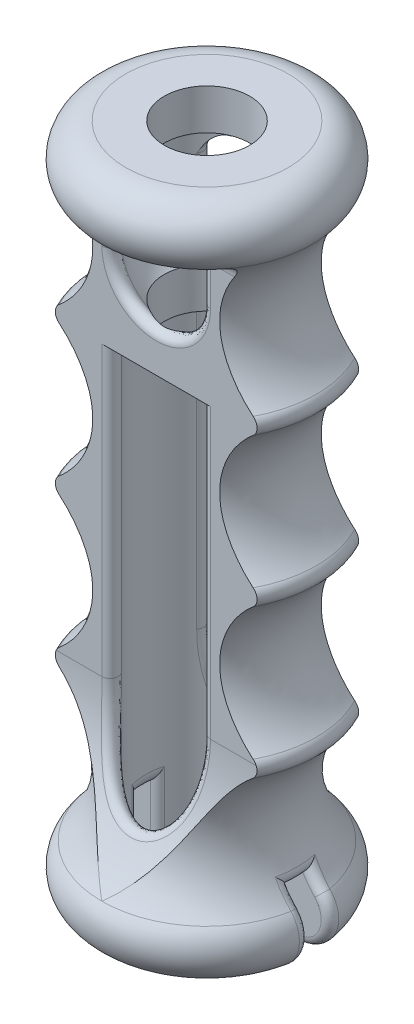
SolidWorks part; units mm, degrees
ref_plane "Front Plane" through (0, 0, 0) normal (0, 0, 1) x (1, 0, 0)
ref_plane "Top Plane" through (0, 0, 0) normal (0, 1, 0) x (1, 0, 0)
ref_plane "Right Plane" through (0, 0, 0) normal (1, 0, 0) x (0, 0, -1)
sketch "Sketch1" plane through (0, 0, 0) normal (0, 0, 1) x (1, 0, 0)
  line L0 (0, 0) -> (0, -84.6703) construction
  line L1 (-6.6675, 0) -> (-6.6675, -6.35)
  line L2 (-6.6675, -6.35) -> (-9.525, -6.35)
  line L3 (-9.525, -6.35) -> (-9.525, -17.2314)
  line L4 (-6.6675, -24.13) -> (-4.2872, -26.5103) construction
  line L5 (-6.6675, -24.13) -> (-6.6675, -30.48)
  line L6 (-6.6675, -30.48) -> (-9.525, -30.48)
  line L7 (-9.525, -30.48) -> (-9.525, -100.8395)
  line L8 (-9.525, -100.8395) -> (0, -100.8395)
  line L9 (0, -100.8395) -> (0, -105.9195)
  line L10 (0, -105.9195) -> (-12.7, -105.9195)
  line L11 (-12.7, 0) -> (-6.6675, 0)
  arc A0 (-12.7, -105.9195) -> (-16.4474, -97.4097) centre (-12.7, -100.8395) cw
  arc A1 (-16.4474, -8.5097) -> (-17.1048, -28.4724) centre (-26.986, -18.1549) cw
  arc A2 (-17.1048, -77.4471) -> (-17.1048, -74.8789) centre (-15.875, -76.163) cw
  arc A3 (-17.1048, -31.0406) -> (-17.1048, -51.6756) centre (-26.986, -41.3581) cw
  arc A4 (-17.1048, -54.2438) -> (-17.1048, -51.6756) centre (-15.875, -52.9597) cw
  arc A5 (-17.1048, -54.2438) -> (-17.1048, -74.8789) centre (-26.986, -64.5614) cw
  arc A6 (-17.1048, -31.0406) -> (-17.1048, -28.4724) centre (-15.875, -29.7565) cw
  arc A7 (-17.1048, -77.4471) -> (-16.4474, -97.4097) centre (-26.986, -87.7646) cw
  arc A8 (-16.4474, -8.5097) -> (-12.7, 0) centre (-12.7, -5.08) cw
  arc A9 (-6.6675, -24.13) -> (-9.525, -17.2314) centre (0.2311, -17.2314) cw
  dimension "D2" = 1.778
  dimension "D3" = 5.08
  dimension "D4" = 6.35
  dimension "D11" = 3.175
  dimension "D1" = 88.9
  dimension "D5" = 6.35
  dimension "D6" = 17.78
  dimension "D7" = 5.08
  dimension "D8" = 19.05
  dimension "D9" = 13.335
  dimension "D10" = 13.335
  dimension "D12" = 6.35
  dimension "D13" = 12.7
  dimension "D14" = 45
revolve "Revolve1" add sketch "Sketch1" angle 360 about L0
sketch "Sketch2" plane through (0, 0, 0) normal (1, 0, 0) x (0, 0, -1)
  line L0 (-16.4474, -8.5097) -> (-7.9375, -8.5097)
  line L1 (-16.4474, -8.5097) -> (16.4474, -8.5097) construction
  line L2 (-7.9375, -8.5097) -> (-7.9375, -75.5069)
  line L3 (0, 0) -> (0, -111.5677) construction
  line L4 (-16.4474, -97.4097) -> (-26.4108, -97.4097)
  line L5 (-26.4108, -97.4097) -> (-26.4108, -8.5097)
  line L6 (-26.4108, -8.5097) -> (-16.4474, -8.5097)
  line L7 (16.4474, -97.4097) -> (26.4108, -97.4097)
  line L8 (26.4108, -97.4097) -> (26.4108, -8.5097)
  line L9 (26.4108, -8.5097) -> (16.4474, -8.5097)
  line L10 (16.4474, -8.5097) -> (7.9375, -8.5097)
  line L11 (7.9375, -8.5097) -> (7.9375, -75.5069)
  arc A0 (-7.9375, -75.5069) -> (-16.4474, -97.4097) centre (-40.3791, -75.5069) cw
  arc A1 (-16.4474, -97.4097) -> (-12.7, -105.9195) centre (-12.7, -100.8395) ccw construction
  arc A3 (7.9375, -75.5069) -> (16.4474, -97.4097) centre (40.3791, -75.5069) ccw
  dimension "D1" = 15.875
extrude "Cut-Extrude1" cut sketch "Sketch2" against normal through all and the other way through all
fillet "Fillet1" radius 1.27 12 edges at (5.2651, -52.9935, -7.9375) (-5.2651, -52.9935, -7.9375) (0.55, -65.5319, -9.5091) (-5.2651, -52.9935, 7.9375) (5.2651, -52.9935, 7.9375) (-0.55, -65.5319, 9.5091) (5.2651, -12.8706, -7.9375) (-5.2651, -12.8706, -7.9375) (-5.2651, -12.8706, 7.9375) (5.2651, -12.8706, 7.9375) (0.54, -11.9252, -7.9375) (-0.54, -11.9252, 7.9375)
sketch "Sketch3" plane through (0, -100.8395, 0) normal (0, 1, 0) x (-1, 0, 0)
  circle A0 centre (0, 0) radius 9.525
  circle A2 centre (0, 0) radius 9.525 construction
extrude "Cut-Extrude2" cut sketch "Sketch3" against normal through all
fillet "Fillet2" radius 2.54 8 edges at (7.3476, -8.5097, 7.2228) (-7.3476, -8.5097, 7.2228) (-7.3476, -8.5097, -7.2228) (7.3476, -8.5097, -7.2228) (11.4476, -8.5097, 7.9375) (-11.4476, -8.5097, 7.9375) (-11.4476, -8.5097, -7.9375) (11.4476, -8.5097, -7.9375)
sketch "Sketch6" plane through (0, -105.9195, 0) normal (0, -1, 0) x (1, 0, 0)
  line L0 (-19.05, 1.5875) -> (19.05, 1.5875)
  line L1 (19.05, 1.5875) -> (19.05, -1.5875)
  line L2 (19.05, -1.5875) -> (-19.05, -1.5875)
  line L3 (-19.05, -1.5875) -> (-19.05, 1.5875)
  point P4 (19.05, 0)
  point P5 (0, 1.5875)
  dimension "D1" = 3.175
  dimension "D2" = 38.1
extrude "Cut-Extrude4" cut sketch "Sketch6" against normal blind 10.16
fillet "Fillet3" radius 2.54 2 edges at (-9.525, -95.7595, 0) (9.525, -95.7595, 0)
fillet "Fillet4" radius 1.27 18 edges at (39.1851, -80.3832, 1.5875) (17.2443, -102.958, 1.5875) (-8.232, -98.1608, 1.5875) (10.9961, -105.9195, 1.5875) (-10.9961, -105.9195, 1.5875) (-10.9961, -105.9195, -1.5875) (10.9961, -105.9195, -1.5875) (-39.1851, -80.3832, -1.5875) (-7.7686, -99.0943, -1.5875) (16.6954, -103.8786, -1.5875) (-9.3918, -99.5695, 1.5875) (9.3918, -99.5695, 1.5875) (15.1466, -95.7595, 0) (-15.1466, -95.7595, 0) (9.3918, -99.5695, -1.5875) (-9.3918, -99.5695, -1.5875)
